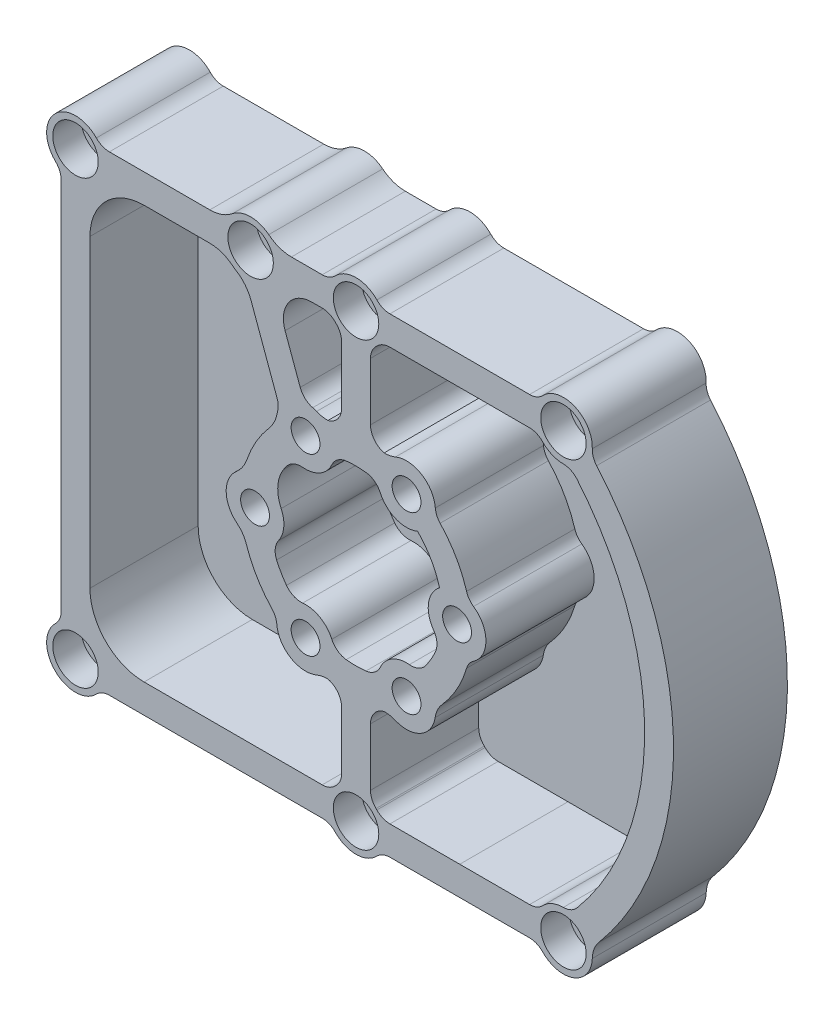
SolidWorks part; units mm, degrees
ref_plane "Front" through (0, 0, 0) normal (0, 0, 1) x (1, 0, 0)
ref_plane "Top" through (0, 0, 0) normal (0, 1, 0) x (1, 0, 0)
ref_plane "Right" through (0, 0, 0) normal (1, 0, 0) x (0, 0, -1)
other "Imported1"
sketch "Sketch1" plane through (0, 0, -19.05) normal (0, 0, -1) x (-1, 0, 0)
  line L6 (14.8136, 23.1024) -> (9.3937, 23.1024)
  line L7 (-2.5199, 23.1024) -> (-27.1108, 23.1024)
  line L8 (-27.1107, -59.7352) -> (-2.52, -59.7352)
  line L9 (9.3937, -59.7353) -> (46.8622, -59.7353)
  line L10 (55.3591, -51.2384) -> (55.3591, 14.6056)
  line L11 (46.8622, 23.1024) -> (29.182, 23.1024)
  line L12 (14.8136, 23.1024) -> (9.3937, 23.1024)
  line L13 (-2.5199, 23.1024) -> (-27.1108, 23.1024)
  line L14 (-27.1107, -59.7352) -> (-2.52, -59.7352)
  line L15 (9.3937, -59.7353) -> (46.8622, -59.7353)
  line L16 (55.3591, -51.2384) -> (55.3591, 14.6056)
  line L17 (46.8622, 23.1024) -> (29.182, 23.1024)
  circle A0 centre (52.8191, -57.1953) radius 2.54 construction
  circle A1 centre (52.8191, -57.1953) radius 2.54
  circle A2 centre (52.8191, 20.5624) radius 2.54 construction
  circle A3 centre (21.9978, 20.5624) radius 2.54 construction
  circle A4 centre (3.4369, 20.5624) radius 2.54 construction
  circle A5 centre (-33.0676, 20.5624) radius 2.54 construction
  circle A6 centre (-33.0677, -57.1954) radius 2.54 construction
  circle A7 centre (3.4369, -57.1952) radius 2.54 construction
  circle A8 centre (52.8191, 20.5624) radius 2.54
  circle A9 centre (21.9978, 20.5624) radius 2.54
  circle A10 centre (3.4369, 20.5624) radius 2.54
  circle A11 centre (-33.0676, 20.5624) radius 2.54
  circle A12 centre (-33.0677, -57.1954) radius 2.54
  circle A13 centre (3.4369, -57.1952) radius 2.54
  circle A14 centre (-5.4531, -2.9185) radius 2.54 construction
  circle A15 centre (-14.3431, -18.3164) radius 2.54
  circle A16 centre (-14.3431, -18.3164) radius 2.54
  circle A17 centre (12.3269, -2.9185) radius 2.54 construction
  circle A18 centre (21.2169, -18.3164) radius 2.54 construction
  circle A19 centre (12.3269, -33.7143) radius 2.54 construction
  circle A20 centre (-5.4531, -33.7144) radius 2.54 construction
  circle A21 centre (-5.4531, -2.9185) radius 2.54
  arc A22 (25.1908, 24.5135) -> (29.182, 23.1024) centre (29.182, 29.4524) ccw
  arc A23 (25.1908, 24.5135) -> (18.8048, 24.5135) centre (21.9978, 20.5624) ccw
  arc A24 (14.8136, 23.1024) -> (18.8048, 24.5135) centre (14.8136, 29.4524) ccw
  arc A25 (7.1026, 24.0793) -> (9.3937, 23.1024) centre (9.3937, 26.2774) ccw
  arc A26 (7.1026, 24.0793) -> (-0.2288, 24.0793) centre (3.4369, 20.5624) ccw
  arc A27 (-2.5199, 23.1024) -> (-0.2288, 24.0793) centre (-2.5199, 26.2774) ccw
  arc A28 (-29.4018, 24.0793) -> (-27.1108, 23.1024) centre (-27.1108, 26.2774) ccw
  arc A29 (-29.4018, 24.0793) -> (-38.1431, 20.3491) centre (-33.0676, 20.5624) ccw
  arc A30 (-38.9093, 18.1441) -> (-38.1431, 20.3491) centre (-41.3153, 20.2157) ccw
  arc A31 (-38.9093, 18.1441) -> (-39.3169, -54.2981) centre (3.4369, -18.3164) ccw
  arc A32 (-38.145, -57.3578) -> (-39.3169, -54.2981) centre (-43.1424, -57.5176) ccw
  arc A33 (-38.145, -57.3578) -> (-29.4019, -60.7122) centre (-33.0677, -57.1954) ccw
  arc A34 (-27.1107, -59.7352) -> (-29.4019, -60.7122) centre (-27.1107, -62.9102) ccw
  arc A35 (-0.2289, -60.7122) -> (-2.52, -59.7352) centre (-2.52, -62.9102) ccw
  arc A36 (-0.2289, -60.7122) -> (7.1027, -60.7122) centre (3.4369, -57.1952) ccw
  arc A37 (9.3937, -59.7353) -> (7.1027, -60.7122) centre (9.3937, -62.9103) ccw
  arc A38 (49.1533, -60.7122) -> (46.8622, -59.7353) centre (46.8622, -62.9103) ccw
  arc A39 (49.1533, -60.7122) -> (56.336, -53.5295) centre (52.8191, -57.1953) ccw
  arc A40 (55.3591, -51.2384) -> (56.336, -53.5295) centre (58.5341, -51.2384) ccw
  arc A41 (56.336, 16.8967) -> (55.3591, 14.6056) centre (58.5341, 14.6056) ccw
  arc A42 (56.336, 16.8967) -> (49.1533, 24.0793) centre (52.8191, 20.5624) ccw
  arc A43 (46.8622, 23.1024) -> (49.1533, 24.0793) centre (46.8622, 26.2774) ccw
  arc A44 (25.1908, 24.5135) -> (29.182, 23.1024) centre (29.182, 29.4524) ccw
  arc A45 (25.1908, 24.5135) -> (18.8048, 24.5135) centre (21.9978, 20.5624) ccw
  arc A46 (14.8136, 23.1024) -> (18.8048, 24.5135) centre (14.8136, 29.4524) ccw
  arc A47 (7.1026, 24.0793) -> (9.3937, 23.1024) centre (9.3937, 26.2774) ccw
  arc A48 (7.1026, 24.0793) -> (-0.2288, 24.0793) centre (3.4369, 20.5624) ccw
  arc A49 (-2.5199, 23.1024) -> (-0.2288, 24.0793) centre (-2.5199, 26.2774) ccw
  arc A50 (-29.4018, 24.0793) -> (-27.1108, 23.1024) centre (-27.1108, 26.2774) ccw
  arc A51 (-29.4018, 24.0793) -> (-38.1431, 20.3491) centre (-33.0676, 20.5624) ccw
  arc A52 (-38.9093, 18.1441) -> (-38.1431, 20.3491) centre (-41.3153, 20.2157) ccw
  arc A53 (-38.9093, 18.1441) -> (-39.3169, -54.2981) centre (3.4369, -18.3164) ccw
  arc A54 (-38.145, -57.3578) -> (-39.3169, -54.2981) centre (-43.1424, -57.5176) ccw
  arc A55 (-38.145, -57.3578) -> (-29.4019, -60.7122) centre (-33.0677, -57.1954) ccw
  arc A56 (-27.1107, -59.7352) -> (-29.4019, -60.7122) centre (-27.1107, -62.9102) ccw
  arc A57 (-0.2289, -60.7122) -> (-2.52, -59.7352) centre (-2.52, -62.9102) ccw
  arc A58 (-0.2289, -60.7122) -> (7.1027, -60.7122) centre (3.4369, -57.1952) ccw
  arc A59 (9.3937, -59.7353) -> (7.1027, -60.7122) centre (9.3937, -62.9103) ccw
  arc A60 (49.1533, -60.7122) -> (46.8622, -59.7353) centre (46.8622, -62.9103) ccw
  arc A61 (49.1533, -60.7122) -> (56.336, -53.5295) centre (52.8191, -57.1953) ccw
  arc A62 (55.3591, -51.2384) -> (56.336, -53.5295) centre (58.5341, -51.2384) ccw
  arc A63 (56.336, 16.8967) -> (55.3591, 14.6056) centre (58.5341, 14.6056) ccw
  arc A64 (56.336, 16.8967) -> (49.1533, 24.0793) centre (52.8191, 20.5624) ccw
  arc A65 (46.8622, 23.1024) -> (49.1533, 24.0793) centre (46.8622, 26.2774) ccw
  circle A66 centre (12.3269, -2.9185) radius 2.54
  circle A67 centre (21.2169, -18.3164) radius 2.54
  circle A68 centre (12.3269, -33.7143) radius 2.54
  circle A69 centre (-5.4531, -33.7144) radius 2.54
  dimension "D1" = 0
  dimension "D2" = 0
extrude "Boss-Extrude1" add sketch "Sketch1" along normal blind 1
sketch "Stock" plane through (0, 0, -20.05) normal (0, 0, -1) x (-1, 0, 0)
  line L0 (64.4645, 29.4524) -> (-59.2866, 29.4524)
  line L1 (64.4645, 29.4524) -> (64.4645, -67.1217)
  line L2 (-59.2866, -67.1217) -> (64.4645, -67.1217)
  line L3 (-59.2866, -67.1217) -> (-59.2866, 29.4524)
